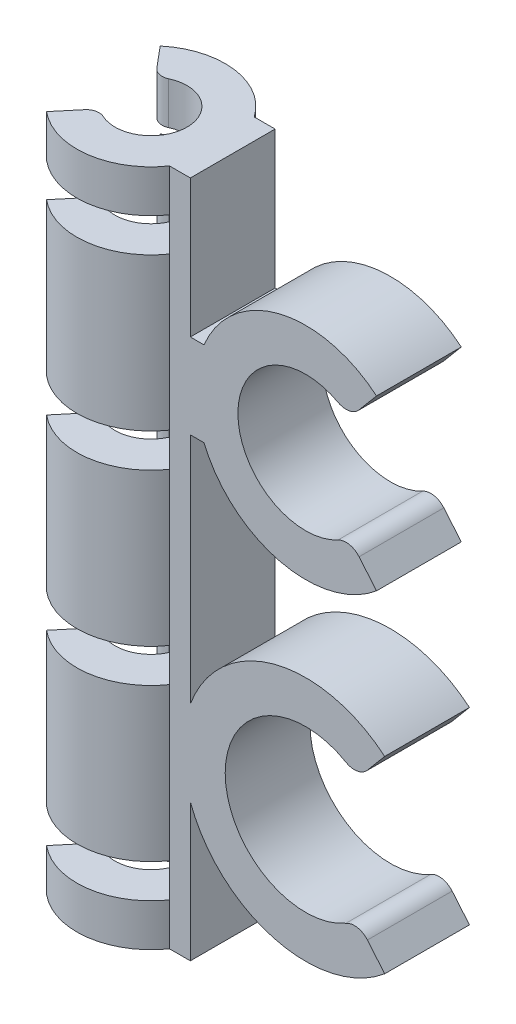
SolidWorks part; units mm, degrees
ref_plane "Front Plane" through (0, 0, 0) normal (0, 0, 1) x (1, 0, 0)
ref_plane "Top Plane" through (0, 0, 0) normal (0, 1, 0) x (1, 0, 0)
ref_plane "Right Plane" through (0, 0, 0) normal (1, 0, 0) x (0, 0, -1)
sketch "Sketch1" plane through (0, 0, 0) normal (0, 1, 0) x (1, 0, 0)
  line L0 (-2.7318, 3.2557) -> (-5.6244, 6.7029)
  line L1 (-5.6244, -6.7029) -> (-2.7318, -3.2557)
  line L2 (0, 7.2069) -> (0, -7.5067) construction
  line L3 (0, -55) -> (0, 55) construction
  circle A0 centre (0, 0) radius 4.05 construction
  arc A1 (-2.7318, -3.2557) -> (-2.7318, 3.2557) centre (0, 0) ccw
  arc A2 (-5.6244, -6.7029) -> (-5.6244, 6.7029) centre (0, 0) ccw
  point P11 (0, 0)
  dimension "D1" = 8.1
  dimension "D2" = 0.2
  dimension "D3" = 4.5
  dimension "D4" = 100
  dimension "D5" = 40
extrude "Boss-Extrude1" add sketch "Sketch1" along normal mid plane 80
sketch "Sketch2" plane through (0, 0, 0) normal (0, 0, 1) x (1, 0, 0)
  line L0 (31.6062, 28.7086) -> (28.3923, 24.8784)
  line L1 (31.6062, 8.7914) -> (28.3923, 12.6216)
  line L2 (23.25, 18.75) -> (23.25, -18.75) construction
  line L3 (23.25, -4.25) -> (23.25, 5.75) construction
  line L4 (-5.6244, 0) -> (43.9473, 0) construction
  line L5 (32.5704, -29.8576) -> (29.3565, -26.0274)
  line L6 (32.5704, -7.6424) -> (29.3565, -11.4726)
  line L7 (23.25, -18.75) -> (23.25, -41.1615) construction
  line L8 (-5.6244, 40) -> (-5.6244, -40) construction
  line L9 (9.625, 0) -> (-9.625, 0) construction
  line L10 (4.25, 23.75) -> (11.25, 23.75)
  line L11 (4.25, 13.75) -> (11.25, 13.75)
  line L12 (23.25, 18.75) -> (-9.0431, 18.75) construction
  line L13 (4.25, 13.75) -> (4.25, 23.75)
  line L14 (4.25, -13.75) -> (9.6393, -13.75)
  line L15 (4.25, -23.75) -> (9.6393, -23.75)
  line L16 (23.25, -18.75) -> (-12.5685, -18.75) construction
  line L17 (4.25, -13.75) -> (4.25, -23.75)
  line L20 (4.25, 40) -> (4.25, -53.8794) construction
  circle A0 centre (23.25, 18.75) radius 6.5 construction
  arc A1 (28.3923, 24.8784) -> (28.3923, 12.6216) centre (23.25, 18.75) ccw
  arc A2 (31.6062, 28.7086) -> (31.6062, 8.7914) centre (23.25, 18.75) ccw
  arc A4 (29.3565, -11.4726) -> (29.3565, -26.0274) centre (23.25, -18.75) ccw
  arc A5 (32.5704, -7.6424) -> (32.5704, -29.8576) centre (23.25, -18.75) ccw
  point P10 (23.25, 0)
  point P31 (4.25, -18.75)
  point P33 (4.25, 18.75)
  point P36 (0, 0)
  point P37 (0, 0)
  point P38 (8.75, -18.75)
  point P39 (0, 0)
  point P41 (0, 0)
  dimension "D1" = 13
  dimension "D2" = 8
  dimension "D3" = 5
  dimension "D6" = 9.5
  dimension "D7" = 5
  dimension "D8" = 10
  dimension "D4" = 100
  dimension "D5" = 40
  dimension "D9" = 10
  dimension "D10" = 100
  dimension "D11" = 40
  dimension "D12" = 4.5
  dimension "D13" = 10
extrude "Boss-Extrude2" add sketch "Sketch2" along normal mid plane 10 contours A2 L10 L13 L11 | L0 A2 L1 A1 | A5 L14 L17 L15 | L6 A5 L5 A4
sketch "Sketch5" plane through (0, 0, 0) normal (0, 0, 1) x (1, 0, 0)
  line L0 (-5.6244, 35) -> (7.3756, 35)
  line L1 (-5.6244, 40) -> (-5.6244, -40) construction
  line L2 (7.3756, 35) -> (7.3756, 31)
  line L3 (7.3756, 31) -> (-5.6244, 31)
  line L4 (8.75, 40) -> (-5.6244, 40) construction
  line L5 (-5.6244, -9) -> (7.3756, -9)
  line L6 (-5.6244, 13) -> (7.3756, 13)
  line L7 (7.3756, 13) -> (7.3756, 9)
  line L8 (7.3756, 9) -> (-5.6244, 9)
  line L9 (7.3756, -9) -> (7.3756, -13)
  line L10 (7.3756, -13) -> (-5.6244, -13)
  line L11 (-5.6244, -31) -> (7.3756, -31)
  line L12 (7.3756, -31) -> (7.3756, -35)
  line L13 (7.3756, -35) -> (-5.6244, -35)
  line L15 (-5.6244, 35) -> (-5.6244, 31)
  line L16 (-5.6244, 13) -> (-5.6244, 9)
  line L17 (-5.6244, -9) -> (-5.6244, -13)
  line L18 (-5.6244, -31) -> (-5.6244, -35)
  dimension "D1" = 5
  dimension "D2" = 13
  dimension "D3" = 4
  dimension "D4" = 18
  dimension "D5" = 18
  dimension "D6" = 18
extrude "Cut-Extrude1" cut sketch "Sketch5" against normal through all both and the other way through all contours L0 L15 L3 L2 | L6 L16 L8 L7 | L5 L17 L10 L9 | L11 L18 L13 L12
fillet "Fillet1" radius 2 4 edges at (28.3923, 12.6216, 0) (28.3923, 24.8784, 0) (29.3565, -26.0274, 0) (29.3565, -11.4726, 0)
fillet "Fillet2" radius 1.5 10 edges at (-2.7318, -37.5, 3.2557) (-2.7318, -37.5, -3.2557) (-2.7318, -22, -3.2557) (-2.7318, -22, 3.2557) (-2.7318, 0, -3.2557) (-2.7318, 0, 3.2557) (-2.7318, 22, -3.2557) (-2.7318, 22, 3.2557) (-2.7318, 37.5, 3.2557) (-2.7318, 37.5, -3.2557)
sketch "Sketch6" plane through (0, -40, 0) normal (0, -1, 0) x (1, 0, 0)
  line L3 (9.6393, 5) -> (7.1807, 5)
  line L4 (7.1807, -5) -> (9.6393, -5)
  line L5 (9.6393, -5) -> (9.6393, 5)
  line L6 (9.6393, 5) -> (7.1807, 5)
  line L7 (7.1807, -5) -> (9.6393, -5)
  line L8 (9.6393, -5) -> (9.6393, 5)
  arc A1 (7.1807, -5) -> (7.1807, 5) centre (0, 0) ccw
  arc A2 (7.1807, -5) -> (7.1807, 5) centre (0, 0) ccw
  dimension "D1" = 0
extrude "Boss-Extrude3" add sketch "Sketch6" against normal up to vertex (80 mm away)
